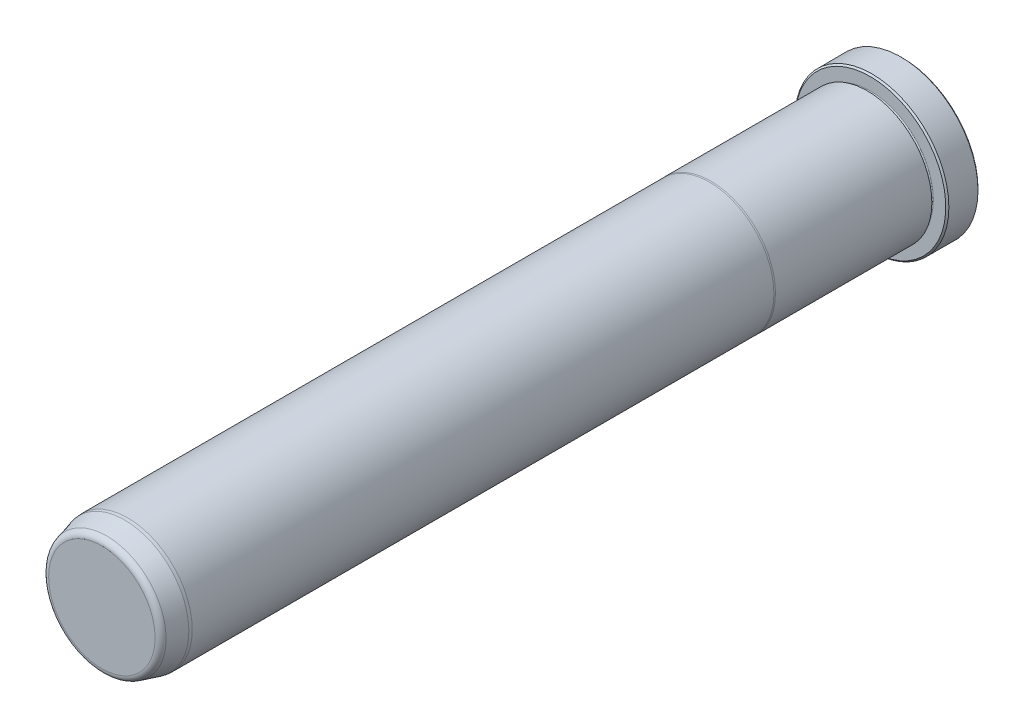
SolidWorks part; units mm, degrees
ref_plane "Front Plane" through (0, 0, 0) normal (0, 0, 1) x (1, 0, 0)
ref_plane "Top Plane" through (0, 0, 0) normal (0, 1, 0) x (1, 0, 0)
ref_plane "Right Plane" through (0, 0, 0) normal (1, 0, 0) x (0, 0, -1)
sketch "Sketch1" plane through (0, 0, 0) normal (1, 0, 0) x (0, 0, -1)
  line L0 (0, 0) -> (0, 18.923)
  line L1 (0, 18.923) -> (-7.9248, 18.923)
  line L2 (-7.9248, 18.923) -> (-7.9248, 15.4813)
  line L3 (-4.7498, 15.1003) -> (-5.5118, 15.1003) construction
  line L4 (-8.6868, 15.4813) -> (-8.6868, 15.8877)
  line L5 (-8.6868, 15.8877) -> (-47.1348, 15.8877)
  line L6 (-47.1348, 15.8877) -> (-47.498, 15.8623)
  line L7 (-47.498, 15.8623) -> (-190.5, 15.8623)
  line L9 (-196.85, 14.2983) -> (-196.85, 0)
  line L10 (-196.85, 0) -> (0, 0)
  line L11 (0, 0) -> (13.6287, 0) construction
  line L12 (-190.5, 15.8623) -> (-191.262, 15.7956)
  line L13 (-191.262, 15.7956) -> (-196.85, 14.2983)
  arc A0 (-8.6868, 15.4813) -> (-7.9248, 15.4813) centre (-8.3058, 15.4813) ccw
  dimension "D14" = 0.762
  dimension "D1" = 7.9248
  dimension "D2" = 0.762
  dimension "D3" = 37.846
  dimension "D4" = 31.7754
  dimension "D5" = 47.498
  dimension "D6" = 196.85
  dimension "D7" = 0.7874
  dimension "D8" = 4
  dimension "D9" = 31.7246
  dimension "D10" = 5
  dimension "D11" = 15
  dimension "D12" = 0.762
  dimension "D13" = 6.35
revolve "Revolve1" add sketch "Sketch1" angle 360 about L11
fillet "Fillet6" radius 1.5875 1 edges at (14.2983, 0, 196.85)
chamfer "Chamfer1" distance 0.381 angle 45 2 edges at (18.923, 0, 0) (18.923, 0, 7.9248)
